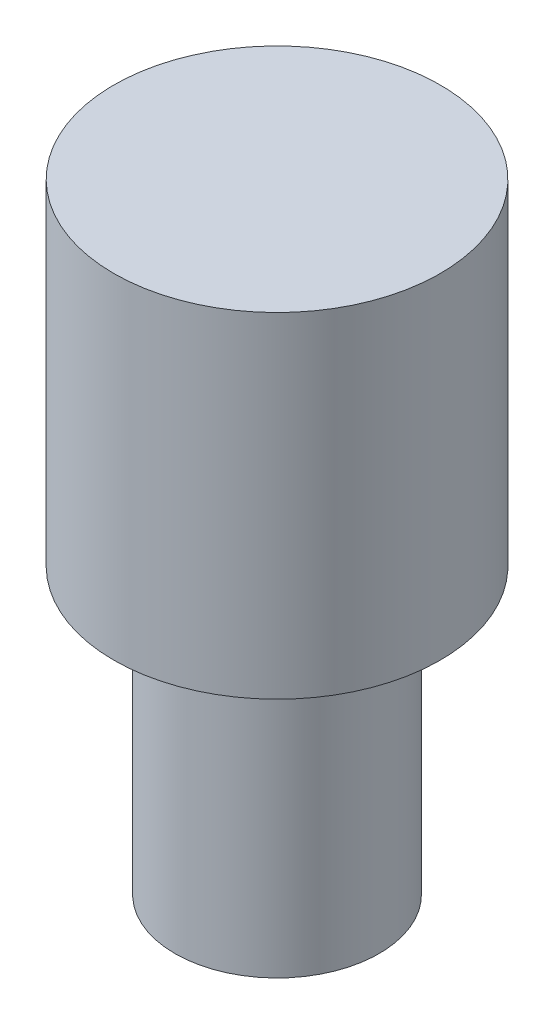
SolidWorks part; units mm, degrees
ref_plane "Plan de face" through (0, 0, 0) normal (0, 0, 1) x (1, 0, 0)
ref_plane "Plan de dessus" through (0, 0, 0) normal (0, 1, 0) x (1, 0, 0)
ref_plane "Plan de droite" through (0, 0, 0) normal (1, 0, 0) x (0, 0, -1)
sketch "Esquisse1" plane through (0, 0, 0) normal (0, 1, 0) x (1, 0, 0)
  circle A0 centre (0, 0) radius 3.9
extrude "Extrusion1" add sketch "Esquisse1" along normal blind 8
sketch "Esquisse2" plane through (0, 0, 0) normal (0, -1, 0) x (1, 0, 0)
  circle A0 centre (0, 0) radius 2.44
extrude "Extrusion2" add sketch "Esquisse2" along normal blind 6.8
